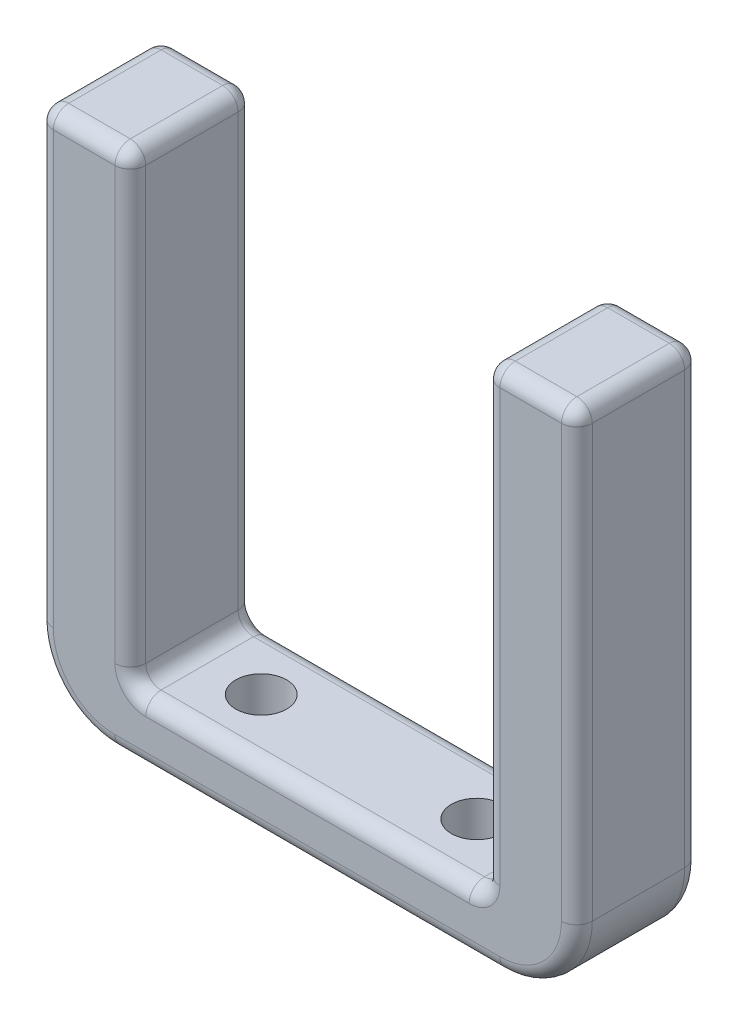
SolidWorks part; units mm, degrees
ref_plane "Front Plane" through (0, 0, 0) normal (0, 0, 1) x (1, 0, 0)
ref_plane "Top Plane" through (0, 0, 0) normal (0, 1, 0) x (1, 0, 0)
ref_plane "Right Plane" through (0, 0, 0) normal (1, 0, 0) x (0, 0, -1)
sketch "Sketch1" plane through (0, 0, 0) normal (0, 0, 1) x (1, 0, 0)
  line L0 (0, 0) -> (35, 0)
  line L3 (0, 0) -> (35, 0)
  line L4 (0, 0) -> (0, -29)
  line L5 (5, -34) -> (30, -34)
  line L6 (35, 0) -> (35, -29)
  arc A0 (30, -34) -> (35, -29) centre (30, -29) ccw
  arc A1 (0, -29) -> (5, -34) centre (5, -29) ccw
  dimension "D3" = 5
  dimension "D1" = 35
extrude "Boss-Extrude1" add sketch "Sketch1" along normal blind 8 contours L4 A1 L5 A0 L6 L0
sketch "Sketch2" plane through (0, 0, 8) normal (0, 0, 1) x (1, 0, 0)
  line L0 (0, 0) -> (35, 0) construction
  line L1 (6, 0) -> (29, 0)
  line L3 (5, -34) -> (30, -34) construction
  line L8 (6, -6) -> (6, -28)
  line L9 (6, -28) -> (29, -28)
  line L10 (29, -28) -> (29, -6)
  line L11 (29, -6) -> (6, -6)
  line L12 (6, 0) -> (6, -29)
  line L13 (7, -30) -> (28, -30)
  line L14 (29, -29) -> (29, 0)
  arc A2 (28, -30) -> (29, -29) centre (28, -29) ccw
  arc A3 (7, -30) -> (6, -29) centre (7, -29) cw
  dimension "D2" = 4
  dimension "D3" = 1
  dimension "D1" = 6
extrude "Cut-Extrude1" cut sketch "Sketch2" against normal blind 10
fillet "Fillet1" radius 1 28 edges at (6, -14.5, 0) (17.5, -30, 0) (29, -14.5, 0) (35, 0, 4) (0, 0, 4) (3, 0, 8) (32, 0, 8) (35, -14.5, 8) (33.5355, -32.5355, 8) (17.5, -34, 8) (1.4645, -32.5355, 8) (0, -14.5, 8) (3, 0, 0) (32, 0, 0) (35, -14.5, 0) (33.5355, -32.5355, 0) (17.5, -34, 0) (1.4645, -32.5355, 0) (0, -14.5, 0) (6, 0, 4) (29, 0, 4) (17.5, -30, 8) (6, -14.5, 8) (29, -14.5, 8) (6.2929, -29.7071, 0) (28.7071, -29.7071, 0) (6.2929, -29.7071, 8) (28.7071, -29.7071, 8)
sketch "Sketch3" plane through (0, -34, 0) normal (0, -1, 0) x (1, 0, 0)
  line L0 (0, 4) -> (35, 4) construction
  line L1 (0, 7) -> (0, 1) construction
  line L2 (35, 7) -> (35, 1) construction
  line L3 (17.5, 8) -> (17.5, 0) construction
  line L4 (5, 8) -> (30, 8) construction
  line L5 (30, 0) -> (5, 0) construction
  circle A0 centre (24.5, 4) radius 1.65
  circle A1 centre (10.5, 4) radius 1.65
  dimension "D1" = 3.3
  dimension "D2" = 7
extrude "Cut-Extrude2" cut sketch "Sketch3" against normal through all
